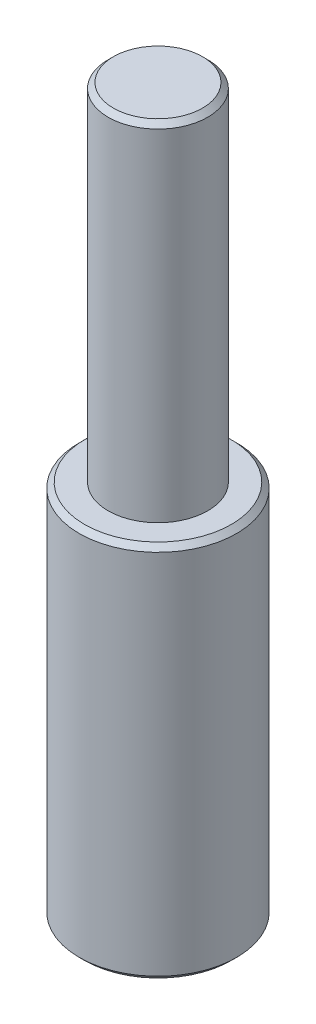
SolidWorks part; units mm, degrees
ref_plane "Front Plane" through (0, 0, 0) normal (0, 0, 1) x (1, 0, 0)
ref_plane "Top Plane" through (0, 0, 0) normal (0, 1, 0) x (1, 0, 0)
ref_plane "Right Plane" through (0, 0, 0) normal (1, 0, 0) x (0, 0, -1)
sketch "Sketch1" plane through (0, 0, 0) normal (0, 1, 0) x (1, 0, 0)
  circle A0 centre (0, 0) radius 1.5
  dimension "D1" = 3
extrude "Boss-Extrude1" add sketch "Sketch1" along normal blind 7.2
sketch "Sketch2" plane through (0, 7.2, 0) normal (0, 1, 0) x (1, 0, 0)
  circle A0 centre (0, 0) radius 0.95
  dimension "D1" = 1.9
extrude "Boss-Extrude2" add sketch "Sketch2" along normal blind 6.6
chamfer "Chamfer1" distance 0.1 angle 45 3 edges at (0, 0, 1.5) (0, 7.2, 1.5) (0, 13.8, 0.95)
hole_wizard "Tap Drill for M2 Tap1" positions "Sketch3" profile "Sketch4" hole size "M2" standard "ISO"
sketch "Sketch3" plane through (0, 0, 0) normal (0, -1, 0) x (-1, 0, 0)
  point P0 (0, 0)
sketch "Sketch4" plane through (0, 0, 0) normal (1, 0, 0) x (0, 0, -1)
  line L0 (0, 0) -> (0, 5.4807)
  line L1 (0, 5.4807) -> (0.8, 5)
  line L2 (0.8, 5) -> (0.8, 0)
  line L5 (0.8, 0) -> (0, 0)
  line L10 (0, 5.4807) -> (-0.8, 5) construction
  line L11 (0, -6.35) -> (0, 107.95) construction
  dimension "Hole Dia." = 1.6
  dimension "Hole Depth" = 5
  dimension "Drill Angle" = 118
